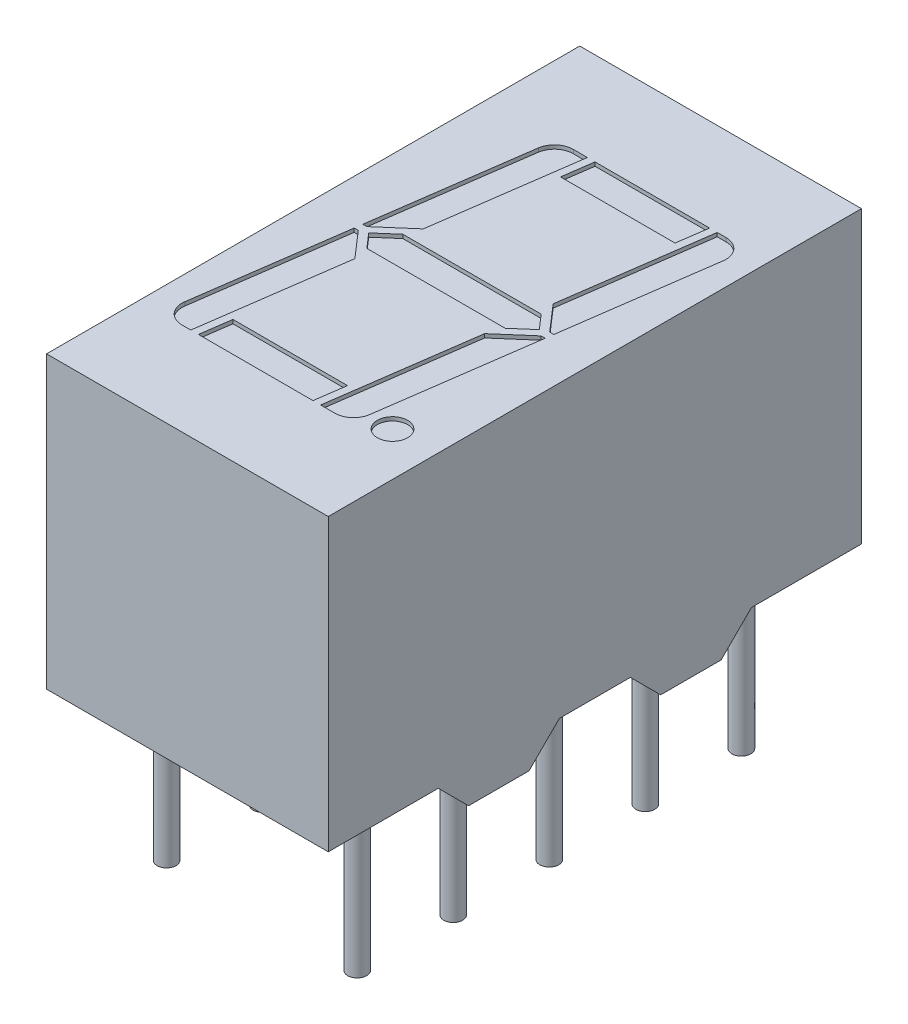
SolidWorks part; units mm, degrees
ref_plane "Front" through (0, 0, 0) normal (0, 0, 1) x (1, 0, 0)
ref_plane "Top" through (0, 0, 0) normal (0, 1, 0) x (1, 0, 0)
ref_plane "Right" through (0, 0, 0) normal (1, 0, 0) x (0, 0, -1)
sketch "Эскиз1" plane through (0, 0, 0) normal (0, 0, 1) x (1, 0, 0)
  line L0 (-3.725, 0) -> (-2.9, 0)
  line L1 (-2.9, 0) -> (-2.9, 0.8)
  line L2 (-3.725, 0) -> (-3.725, 8.48)
  line L3 (-3.725, 8.48) -> (3.725, 8.48)
  line L4 (3.725, 0) -> (3.725, 8.48)
  line L5 (-2.9, 0.8) -> (2.9, 0.8)
  line L6 (0, 0.8) -> (0, 0) construction
  line L7 (2.9, 0) -> (2.9, 0.8)
  line L8 (3.725, 0) -> (2.9, 0)
  dimension "D1" = 8.48
  dimension "D2" = 7.45
  dimension "D3" = 5.8
  dimension "D4" = 0.8
  dimension "D5" = 7.68
extrude "Вытянуть1" add sketch "Эскиз1" along normal mid plane 14.1
sketch "Эскиз4" plane through (0, 0, 0) normal (1, 0, 0) x (0, 0, -1)
  line L0 (-7.05, 0.8) -> (-4.14, 0.8)
  line L1 (-7.05, 0) -> (-7.05, 8.48) construction
  line L2 (-4.14, 0.8) -> (-3.34, 0)
  line L3 (-7.05, 0) -> (7.05, 0) construction
  line L4 (-3.34, 0) -> (-1.74, 0)
  line L5 (-1.74, 0) -> (-0.94, 0.8)
  line L6 (1.74, 0) -> (0.94, 0.8)
  line L7 (0, 0.8) -> (0, 0) construction
  line L8 (3.34, 0) -> (1.74, 0)
  line L9 (4.14, 0.8) -> (3.34, 0)
  line L10 (7.05, 0.8) -> (4.14, 0.8)
  line L11 (-0.94, 0.8) -> (0.94, 0.8)
  line L12 (-2.54, 0) -> (-2.54, 1.4387) construction
  dimension "D1" = 45
  dimension "D2" = 4.51
  dimension "D3" = 1.6
extrude "Вытянуть4" cut sketch "Эскиз4" against normal through all and the other way through all
sketch "Эскиз2" plane through (0, 0, 0) normal (0, 1, 0) x (1, 0, 0)
  line L0 (-2.52, 0) -> (2.52, 0) construction
  circle A0 centre (-2.52, -5.08) radius 0.25
  circle A1 centre (2.52, -5.08) radius 0.25
  circle A2 centre (-2.52, -2.54) radius 0.25
  circle A3 centre (2.52, -2.54) radius 0.25
  circle A4 centre (-2.52, 0) radius 0.25
  circle A5 centre (2.52, 0) radius 0.25
  circle A6 centre (-2.52, 2.54) radius 0.25
  circle A7 centre (2.52, 2.54) radius 0.25
  circle A8 centre (-2.52, 5.08) radius 0.25
  circle A9 centre (2.52, 5.08) radius 0.25
  dimension "D1" = 2.54
  dimension "D2" = 5.04
  dimension "D3" = 0.5
extrude "Вытянуть2" add sketch "Эскиз2" against normal blind 3.5 and the other way blind 2.5
sketch "Эскиз3" plane through (0, 8.48, 0) normal (0, 1, 0) x (-1, 0, 0)
  line L0 (3.0907, 4.0279) -> (2.5386, 0.1)
  line L1 (2.5386, 0.1) -> (2.4308, 0.1)
  line L2 (1.8282, 0.7932) -> (2.3628, 4.5975)
  line L3 (2.3628, 4.5975) -> (2.5955, 4.5975)
  line L4 (2.5105, -0.1) -> (1.9389, -4.1671)
  line L5 (1.4438, -4.5975) -> (1.0706, -4.5975)
  line L6 (1.0706, -4.5975) -> (1.6052, -0.7932)
  line L7 (2.4027, -0.1) -> (2.5105, -0.1)
  line L8 (-1.8282, -0.7932) -> (-2.3628, -4.5975)
  line L9 (-2.3628, -4.5975) -> (-2.5955, -4.5975)
  line L10 (-3.0907, -4.0279) -> (-2.5386, -0.1)
  line L11 (-2.5386, -0.1) -> (-2.4308, -0.1)
  line L12 (-1.0706, 4.5975) -> (-1.6052, 0.7932)
  line L13 (-2.4027, 0.1) -> (-2.5105, 0.1)
  line L14 (-2.5105, 0.1) -> (-1.9389, 4.1671)
  line L15 (-1.4438, 4.5975) -> (-1.0706, 4.5975)
  line L16 (2.1609, 4.5975) -> (2.0484, 3.7975)
  line L17 (2.0484, 3.7975) -> (-0.981, 3.7975)
  line L18 (-0.981, 3.7975) -> (-0.8686, 4.5975)
  line L19 (-0.8686, 4.5975) -> (2.1609, 4.5975)
  line L20 (0.981, -3.7975) -> (-2.0484, -3.7975)
  line L21 (0.981, -3.7975) -> (0.8686, -4.5975)
  line L22 (-2.0484, -3.7975) -> (-2.1609, -4.5975)
  line L23 (0.8686, -4.5975) -> (-2.1609, -4.5975)
  line L24 (0, 0) -> (0, -7.05) construction
  line L25 (-3.725, -7.05) -> (3.725, -7.05) construction
  line L26 (1.6052, -0.7932) -> (2.4027, -0.1)
  line L27 (2.4308, 0.1) -> (1.8282, 0.7932)
  line L28 (-2.4308, -0.1) -> (-1.8282, -0.7932)
  line L29 (-1.6052, 0.7932) -> (-2.4027, 0.1)
  line L30 (1.7527, -0.4) -> (-1.905, -0.4)
  line L31 (1.474, -0.6422) -> (2.2714, 0.0509) construction
  line L32 (2.2798, -0.0312) -> (1.6772, 0.662) construction
  line L33 (-2.2798, 0.0312) -> (-1.6772, -0.662) construction
  line L34 (-1.474, 0.6422) -> (-2.2714, -0.0509) construction
  line L35 (-1.7527, 0.4) -> (1.905, 0.4)
  line L36 (-2.2355, -0.0197) -> (-1.905, -0.4)
  line L37 (1.7527, -0.4) -> (2.2355, 0.0197)
  line L38 (2.2355, 0.0197) -> (1.905, 0.4)
  line L39 (-1.7527, 0.4) -> (-2.2355, -0.0197)
  line L40 (0, 0) -> (3.725, 0) construction
  line L41 (3.725, 7.05) -> (3.725, -7.05) construction
  line L42 (-0.0761, -0.4) -> (0.0761, 0.4) construction
  arc A0 (3.0907, 4.0279) -> (2.5955, 4.5975) centre (2.5955, 4.0975) ccw
  arc A1 (-1.9389, 4.1671) -> (-1.4438, 4.5975) centre (-1.4438, 4.0975) cw
  arc A2 (1.9389, -4.1671) -> (1.4438, -4.5975) centre (1.4438, -4.0975) cw
  arc A3 (-2.5955, -4.5975) -> (-3.0907, -4.0279) centre (-2.5955, -4.0975) cw
  circle A4 centre (-2.5706, 4.1975) radius 0.4
  point P3 (1.7308, 0.1)
  point P7 (1.7027, -0.1)
  point P8 (-1.7308, -0.1)
  point P13 (-1.7027, 0.1)
  dimension "D16" = 0.5
  dimension "D18" = 0.8
  dimension "D1" = 0.2
  dimension "D2" = 0.2
  dimension "D3" = 0.2
  dimension "D4" = 5
  dimension "D7" = 8
  dimension "D15" = 9.195
  dimension "D17" = 1.5
  dimension "D8" = 0.2
extrude "Вытянуть3" cut sketch "Эскиз3" against normal blind 0.1
equation "\"D2@Эскиз3\" = \"D1@Эскиз3\""
equation "\"D3@Эскиз3\" = \"D1@Эскиз3\""
